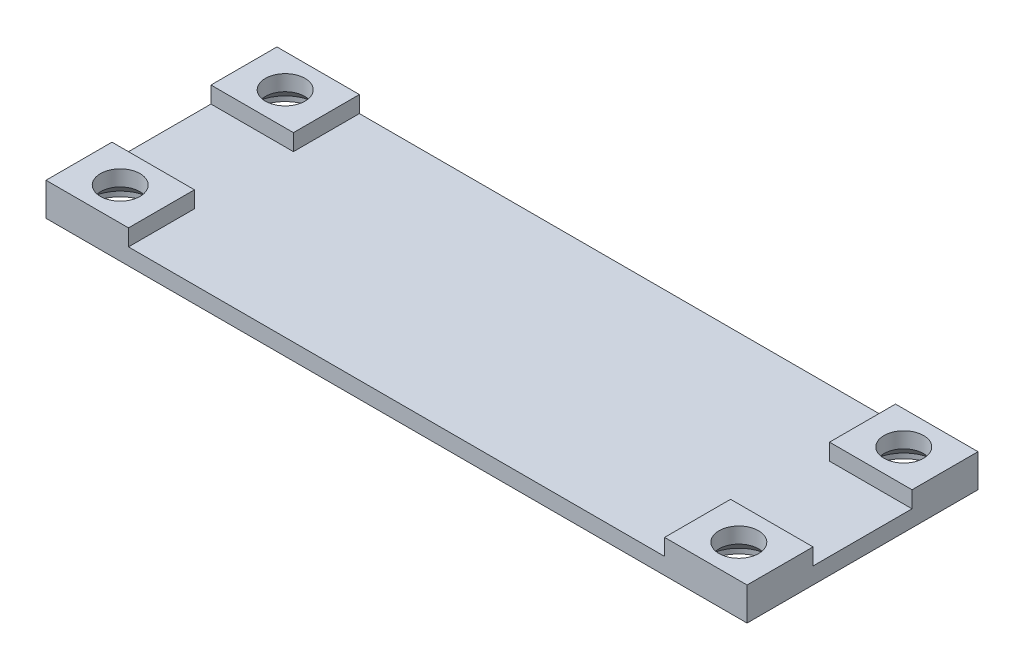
SolidWorks part; units mm, degrees
ref_plane "Спереди" through (0, 0, 0) normal (0, 0, 1) x (1, 0, 0)
ref_plane "Сверху" through (0, 0, 0) normal (0, 1, 0) x (1, 0, 0)
ref_plane "Справа" through (0, 0, 0) normal (1, 0, 0) x (0, 0, -1)
sketch "Эскиз1" plane through (0, 0, 0) normal (0, 1, 0) x (1, 0, 0)
  line L1 (0, 0) -> (42.5, 0)
  line L2 (0, 0) -> (0, 14)
  line L3 (0, 14) -> (42.5, 14)
  line L4 (42.5, 0) -> (42.5, 14)
  dimension "D1" = 42.5
  dimension "D2" = 14
extrude "Бобышка-Вытянуть1" add sketch "Эскиз1" along normal blind 1
sketch "Эскиз2" plane through (0, 1, 0) normal (0, 1, 0) x (1, 0, 0)
  line L0 (42.5, 14) -> (0, 14) construction
  line L1 (0, 14) -> (5, 14)
  line L2 (0, 14) -> (0, 10)
  line L3 (0, 10) -> (5, 10)
  line L4 (5, 14) -> (5, 10)
  line L5 (0, 0) -> (42.5, 0) construction
  line L6 (0, 0) -> (5, 0)
  line L7 (0, 0) -> (0, 4)
  line L8 (0, 4) -> (5, 4)
  line L9 (5, 0) -> (5, 4)
  line L11 (0, 14) -> (0, 0) construction
  line L12 (21.25, 14) -> (21.25, -5.799) construction
  line L13 (37.5, 0) -> (37.5, 4)
  line L14 (42.5, 4) -> (37.5, 4)
  line L15 (42.5, 0) -> (42.5, 4)
  line L16 (42.5, 0) -> (37.5, 0)
  line L17 (37.5, 14) -> (37.5, 10)
  line L18 (42.5, 10) -> (37.5, 10)
  line L19 (42.5, 14) -> (42.5, 10)
  line L20 (42.5, 14) -> (37.5, 14)
  dimension "D1" = 4
  dimension "D2" = 4
  dimension "D4" = 5
extrude "Бобышка-Вытянуть2" add sketch "Эскиз2" along normal blind 1
hole_wizard "Зенковка для винта с полупотайной головкой M26" positions "Трехмерный эскиз1" profile "Эскиз3" countersink size "M2" standard "ГОСТ"
sketch3d "Трехмерный эскиз1"
  line L0 (0, 0, -14) -> (0, 0, 0) construction
  line L1 (2.5, 0, -2) -> (2.5, 0, -24.646) construction
  line L3 (0, 0, 0) -> (42.5, 0, 0) construction
  line L4 (42.5, 0, -14) -> (0, 0, -14) construction
  line L5 (2.5, 0, -12) -> (40, 0, -12) construction
  line L7 (2.5, 0, -2) -> (40, 0, -2) construction
  line L9 (40, 0, -12) -> (40, 0, -2) construction
  line L11 (42.5, 0, 0) -> (42.5, 0, -14) construction
  point P0 (2.5, 0, -2)
  point P2 (2.5, 0, -12)
  point P22 (-13.3228, 0, 3.565)
  point P23 (40, 0, -12)
  point P25 (40, 0, -2)
  dimension "D1" = 2.5
  dimension "D2" = 2
  dimension "D3" = 2
  dimension "D4" = 2.5
sketch "Эскиз3" plane through (2.5, 0, -2) normal (1, 0, 0) x (0, 0, -1)
  line L0 (0, 0) -> (0, 2)
  line L1 (0, 2) -> (1.2, 2)
  line L2 (1.2, 2) -> (1.2, 1.05)
  line L3 (1.2, 1.05) -> (1.95, 0.3)
  line L4 (1.95, 0.3) -> (1.95, 0)
  line L6 (1.95, 0) -> (0, 0)
  line L7 (-1.2, 1.05) -> (-1.95, 0.3) construction
  line L11 (0, -6.35) -> (0, 107.95) construction
  dimension "Диаметр сквозного отверстия" = 2.4
  dimension "Глубина сквозного отверстия" = 2
  dimension "Диаметр зенковки" = 3.9
  dimension "Угол зенковки" = 90
  dimension "Утопленность" = 0.3
